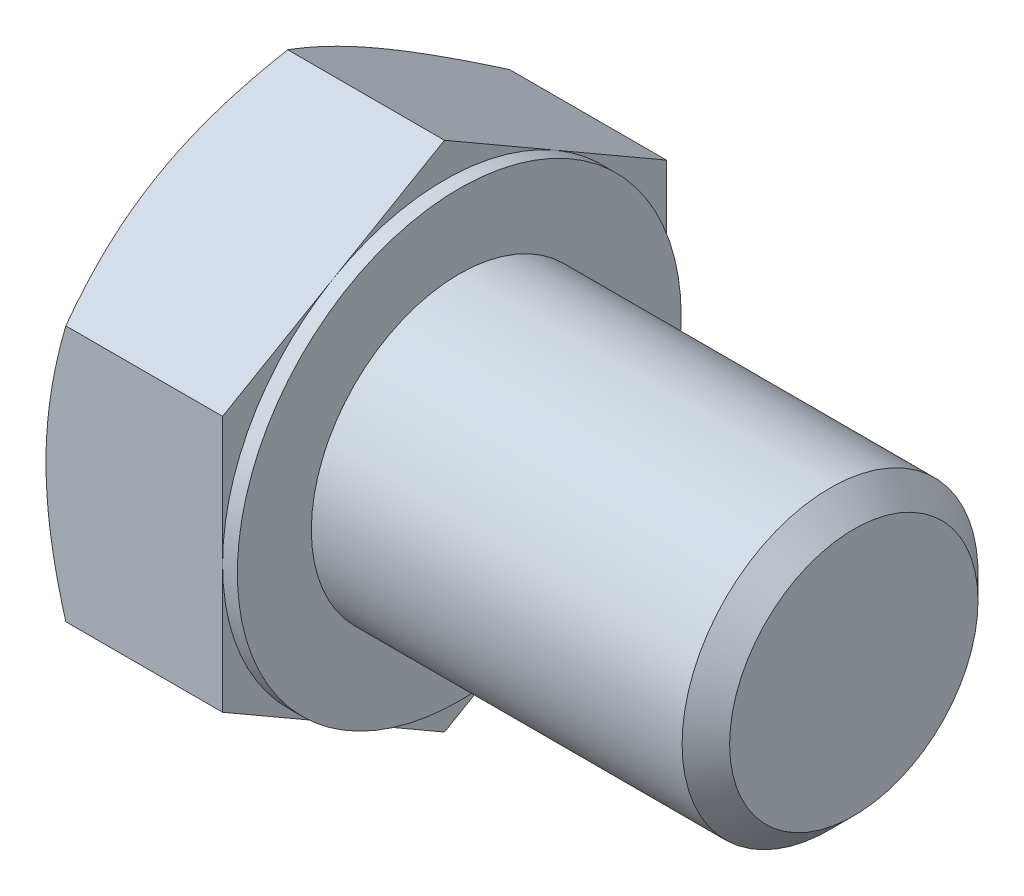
SolidWorks part; units mm, degrees
extrude "BaseHead" add sketch "Sketch1" along normal blind 7.76
sketch "Sketch1" plane through (0, 0, 0) normal (1, 0, 0) x (0, 0, -1)
  line L0 (9, 5.1962) -> (9, -5.1962)
  line L1 (-9, 5.1962) -> (-9, -5.1962)
  line L2 (9, -5.1962) -> (0, -10.3923)
  line L3 (0, -10.3923) -> (-9, -5.1962)
  line L4 (9, 5.1962) -> (0, 10.3923)
  line L5 (0, 10.3923) -> (-9, 5.1962)
revolve "HeadChamfer" cut sketch "Sketch3" angle 360 about L6
sketch "Sketch3" plane through (0, 0, 0) normal (0, 0, 1) x (1, 0, 0)
  line L0 (0, 9) -> (3.6906, 15.3923)
  line L1 (0, 10.3923) -> (0, 5.1962) construction
  line L2 (3.6906, 15.3923) -> (3.6906, 20.3923)
  line L3 (3.6906, 20.3923) -> (-10, 20.3923)
  line L4 (-10, 20.3923) -> (-10, 9)
  line L5 (-10, 9) -> (0, 9)
  line L6 (0, 0) -> (99.06, 0) construction
  line L7 (7.76, 10.3923) -> (0, 10.3923) construction
ref_plane "Plane1" through (0, 0, 0) normal (0, 0, 1) x (1, 0, 0)
ref_plane "Plane2" through (0, 0, 0) normal (0, 1, 0) x (1, 0, 0)
ref_plane "Plane3" through (0, 0, 0) normal (1, 0, 0) x (0, 0, -1)
sketch "BodySke" plane through (0, 0, 0) normal (0, 0, 1) x (1, 0, 0)
  line L0 (0, 5.1962) -> (0, -5.1962) construction
  line L1 (0, 0) -> (23.76, 0)
  line L2 (0, 0) -> (0, 6)
  line L3 (0, 6) -> (22.796, 6)
  line L4 (23.76, 0) -> (23.76, 5.036)
  line L5 (7.76, 10.3923) -> (7.76, 5.1962) construction
  line L6 (23.76, 5.036) -> (22.796, 6)
  line L7 (0, 0) -> (96.52, 0) construction
  line L8 (23.76, -5.036) -> (22.796, -6) construction
  line L9 (0, -6) -> (22.796, -6) construction
  line L10 (9.51, 15.24) -> (9.51, -1.27) construction
  line L11 (7.76, 15.24) -> (7.76, -1.27) construction
  line L12 (7.76, 5.1962) -> (7.76, -5.1962) construction
revolve "BaseBody" add sketch "BodySke"
fillet "HeadFillet" [suppressed] radius 0.6
sketch "Sketch6" plane through (0, 0, 0) normal (-1, 0, 0) x (0, 0, 1)
  circle A0 centre (0.0332, 0.1924) radius 7.875
extrude "Indent" cut sketch "Sketch6" against normal blind 0.97
sketch "Sketch5" plane through (0, 0, 0) normal (0, 0, 1) x (1, 0, 0)
  line L0 (7.76, 9) -> (4.0694, 15.3923)
  line L1 (7.76, 10.3923) -> (7.76, 5.1962) construction
  line L2 (4.0694, 15.3923) -> (4.0694, 20.3923)
  line L3 (4.0694, 20.3923) -> (14.0694, 20.3923)
  line L4 (14.0694, 20.3923) -> (14.0694, 9)
  line L5 (14.0694, 9) -> (7.76, 9)
  line L7 (7.76, 10.3923) -> (0.8038, 10.3923) construction
  line L8 (0, 0) -> (99.06, 0) construction
  line L9 (0, 0) -> (99.06, 0) construction
revolve "UnderHeadChamfer" [suppressed] cut sketch "Sketch5" angle 360 about L8
sketch "Sketch4" plane through (0, 0, 0) normal (0, 0, 1) x (1, 0, 0)
  line L1 (7.76, 10.3923) -> (7.76, 5.1962) construction
  line L2 (7.76, 9) -> (7.16, 9)
  line L3 (7.76, 9) -> (7.76, 20.3923)
  line L4 (7.76, 20.3923) -> (7.16, 20.3923)
  line L5 (0, 0) -> (95.25, 0) construction
  line L6 (0, 0) -> (96.52, 0) construction
  line L7 (7.16, 9) -> (7.16, 20.3923)
  line L8 (7.76, 10.3923) -> (0.8038, 10.3923) construction
revolve "BearingFace" cut sketch "Sketch4" angle 360 about L5
sketch "ThdSchSke" plane through (0, 0, 0) normal (0, 0, 1) x (1, 0, 0)
  line L0 (9.51, -5.036) -> (8.835, -6)
  line L1 (9.51, -5.036) -> (10.185, -6)
  line L2 (10.185, -6) -> (10.185, -7.5)
  line L3 (-3.175, 0) -> (5.1513, 0) construction
  line L5 (10.185, -7.5) -> (8.835, -7.5)
  line L6 (8.835, -7.5) -> (8.835, -6)
revolve "ThreadSchematic" [suppressed] cut sketch "ThdSchSke" angle 360 about L3
pattern_linear "ThdSchPat" [suppressed]
equation "\"D3@Sketch1\" = \"Width_flats@Sketch1\" / 2"
equation "\"D4@Sketch1\" = \"D3@Sketch1\""
equation "\"D5@Sketch1\" = \"D4@Sketch1\""
equation "\"Thread_minor@ThreadCosmetic\" = \"Minor_dia@BodySke\""
equation "\"D1@Sketch3\" = \"Width_flats@Sketch1\" / 2"
equation "\"D1@Sketch5\" = \"Width_flats@Sketch1\" / 2"
equation "\"Head_ch_ang@Sketch5\" = \"Head_ch_ang@Sketch3\""
equation "\"D1@Sketch4\" = \"Width_flats@Sketch1\""
equation "\"D1@Sketch6\" = \"Width_flats@Sketch1\" * 7/8"
equation "\"D1@Indent\" = \"Head_ht@BaseHead\" / 8"
equation "\"Thread_length@ThreadCosmetic\" = ((sgn( (\"Length@BodySke\" - \"Advance@BodySke\" ) - \"Thread_nom@BodySke\" )-1)*( (\"Length@BodySke\" - \"Advance@BodySke\" ) - \"Thread_nom@BodySke\" ))/-2+ \"Thread_nom@BodySke\""
equation "\"Thread_minor@ThdSchSke\" = \"Minor_dia@BodySke\""
equation "\"Diameter@ThdSchSke\" = \"Diameter@BodySke\""
equation "\"Overcut@ThdSchSke\" = \"Diameter@BodySke\" * 1.25"
equation "\"Start@ThdSchSke\" = \"Head_ht@BaseHead\" + \"Length@BodySke\" - \"Thread_length@ThreadCosmetic\"  '---Non-countersunk---"
equation "\"Num_threads@ThdSchPat\" = int( \"Thread_length@ThreadCosmetic\" / \"Advance@BodySke\" + 0.999 )  + 1"
equation "\"Advance@ThdSchPat\" = \"Thread_length@ThreadCosmetic\" /  (\"Num_threads@ThdSchPat\" - 1) 'relax it"
equation "\"Num_threads@ThdSchPat\" = \"Num_threads@ThdSchPat\" - sgn( \"Num_threads@ThdSchPat\" - 1) '---chamfered tips only---"
